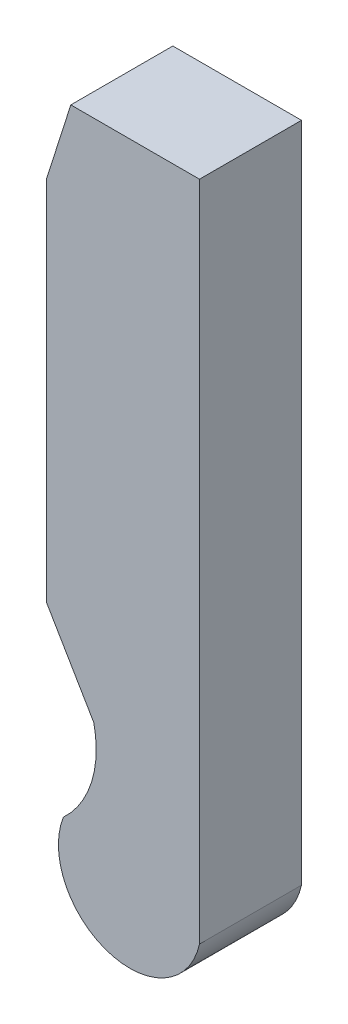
SolidWorks part; units mm, degrees
ref_plane "Front" through (0, 0, 0) normal (0, 0, 1) x (1, 0, 0)
ref_plane "Top" through (0, 0, 0) normal (0, 1, 0) x (1, 0, 0)
ref_plane "Right" through (0, 0, 0) normal (1, 0, 0) x (0, 0, -1)
sketch "Sketch Lever" plane through (0, 0, 0) normal (0, 0, 1) x (1, 0, 0)
  line L1 (5.9663, 1.5246) -> (5.9663, 18.0194)
  line L5 (2.7618, 18.0194) -> (2.1563, 16.1204)
  line L6 (3.3341, 4.985) -> (2.1563, 6.9873)
  line L7 (2.1563, 16.1204) -> (2.1563, 6.9873)
  line L8 (2.7618, 18.0194) -> (5.9663, 18.0194)
  arc A1 (2.579, 2.5691) -> (3.3341, 4.985) centre (0.8545, 4.4341) ccw
  arc A2 (2.579, 2.5691) -> (5.9663, 1.5246) centre (4.2309, 1.9115) ccw
  dimension "D3" = 2.54
  dimension "D1" = 1.778
  dimension "D2" = 3.81
  dimension "D4" = 0.8545
  dimension "D5" = 2.1563
  dimension "D6" = 2.579
  dimension "D7" = 2.7618
  dimension "D8" = 3.3341
  dimension "D9" = 4.2309
  dimension "D10" = 1.5246
  dimension "D11" = 6.9873
  dimension "D16" = 16.1204
  dimension "D17" = 18.0194
extrude "Boss-Extrude Lever" add sketch "Sketch Lever" along normal blind 2.54
